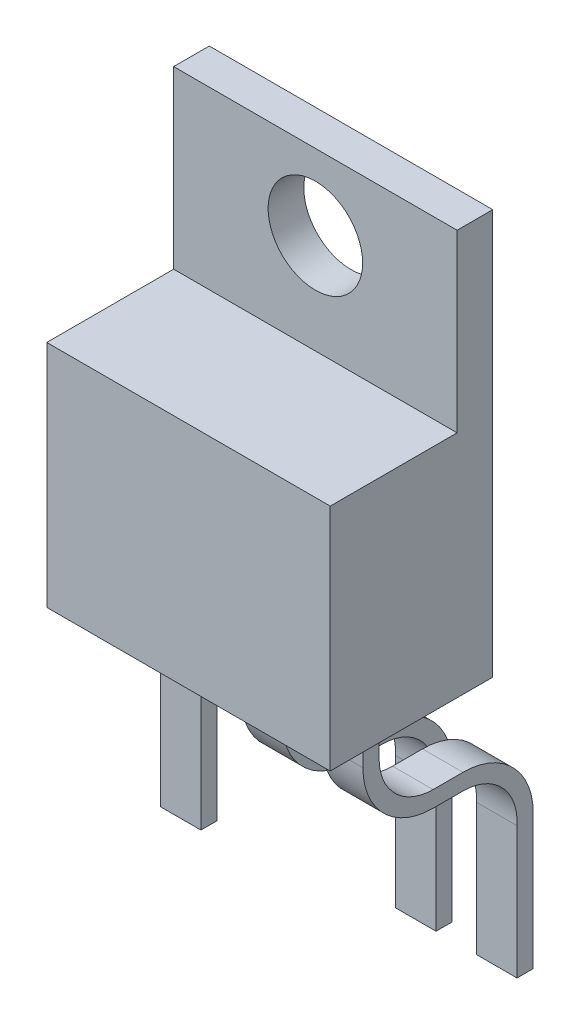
SolidWorks part; units mm, degrees
ref_plane "Спереди" through (0, 0, 0) normal (0, 0, 1) x (1, 0, 0)
ref_plane "Сверху" through (0, 0, 0) normal (0, 1, 0) x (1, 0, 0)
ref_plane "Справа" through (0, 0, 0) normal (1, 0, 0) x (0, 0, -1)
sketch "Эскиз1" plane through (0, 0, 0) normal (0, 0, 1) x (1, 0, 0)
  line L0 (5.25, 15) -> (5.25, 0) construction
  line L1 (0, 0) -> (10.5, 0)
  line L2 (0, 0) -> (0, 15)
  line L3 (0, 15) -> (10.5, 15)
  line L4 (10.5, 0) -> (10.5, 15)
  circle A0 centre (5.25, 12.2) radius 1.75
  dimension "D3" = 3.5
  dimension "D4" = 2.8
  dimension "D1" = 10.5
  dimension "D2" = 15
extrude "Бобышка-Вытянуть1" add sketch "Эскиз1" along normal blind 1.32
sketch "Эскиз2" plane through (0, 0, 1.32) normal (0, 0, 1) x (1, 0, 0)
  line L0 (10.5, 0) -> (10.5, 15) construction
  line L1 (0, 0) -> (10.5, 0)
  line L2 (0, 0) -> (0, 8.5)
  line L3 (0, 8.5) -> (10.5, 8.5)
  line L4 (10.5, 0) -> (10.5, 8.5)
  line L5 (10.5, 15) -> (0, 15) construction
  dimension "D1" = 6.5
extrude "Бобышка-Вытянуть2" add sketch "Эскиз2" along normal blind 4.7
sketch "Эскиз3" plane through (10.5, 0, 0) normal (1, 0, 0) x (0, 0, -1)
  line L0 (-3.01, 0) -> (-3.01, -2.8764) construction
  line L1 (-6.02, 0) -> (0, 0) construction
  line L2 (-2.71, -2) -> (-2.71, 0)
  line L3 (3, -6.6) -> (3, -11.6)
  line L4 (-0.71, -4) -> (0.4, -4)
  line L5 (2.4, -6.71) -> (2.4, -11.6)
  line L6 (-3.31, -2) -> (-3.31, 0)
  line L7 (-3.31, 0) -> (-2.71, 0)
  line L8 (2.4, -11.6) -> (3, -11.6)
  line L9 (-0.71, -4.6) -> (0.4, -4.6)
  line L10 (0, 0) -> (0, 15) construction
  arc A0 (-2.71, -2) -> (-0.71, -4) centre (-0.71, -2) ccw
  arc A1 (0.4, -4) -> (3, -6.6) centre (0.4, -6.6) cw
  arc A2 (2.4, -6.71) -> (0.4, -4.6) centre (0.4, -6.6029) ccw
  arc A3 (-3.31, -2) -> (-0.71, -4.6) centre (-0.71, -2) ccw
  arc A4 (-0.71, -4) -> (3, -6.6) centre (-0.71, -7.9469) cw construction
  arc A5 (-0.71, -4.6) -> (2.4, -6.71) centre (-0.71, -7.9469) cw construction
  dimension "D2" = 2
  dimension "D6" = 3
  dimension "D1" = 0.6
  dimension "D3" = 2
  dimension "D4" = 5
  dimension "D5" = 0.6
extrude "Бобышка-Вытянуть3" add sketch "Эскиз3" against normal blind 10.5
sketch "Эскиз4" plane through (0, 0, 3.31) normal (0, 0, 1) x (1, 0, 0)
  line L0 (5.25, 0) -> (5.25, -11.6) construction
  line L1 (0, 0) -> (10.5, 0) construction
  line L2 (0, -11.6) -> (10.5, -11.6) construction
  line L3 (0, 0) -> (10.5, 0) construction
  line L4 (6, 0) -> (7.5, 0)
  line L5 (6, 0) -> (6, -11.6)
  line L6 (6, -11.6) -> (7.5, -11.6)
  line L7 (7.5, 0) -> (7.5, -11.6)
  line L8 (0, 0) -> (0, -11.6)
  line L9 (9, 0) -> (10.5, 0)
  line L10 (9, 0) -> (9, -11.6)
  line L11 (9, -11.6) -> (10.5, -11.6)
  line L12 (10.5, 0) -> (10.5, -11.6)
  line L13 (1.5, -11.6) -> (0, -11.6)
  line L14 (1.5, 0) -> (1.5, -11.6)
  line L15 (1.5, 0) -> (0, 0)
  line L16 (3, 0) -> (3, -11.6)
  line L17 (4.5, -11.6) -> (3, -11.6)
  line L18 (4.5, 0) -> (4.5, -11.6)
  line L19 (4.5, 0) -> (3, 0)
  dimension "D1" = 1.5
  dimension "D2" = 1.5
  dimension "D3" = 1.5
extrude "Вырез-Вытянуть1" cut sketch "Эскиз4" against normal through all
sketch "Эскиз5" plane through (1.5, 0, 0) normal (-1, 0, 0) x (0, 0, 1)
  line L1 (3.31, -2) -> (-3, -2)
  line L2 (3.31, -2) -> (3.31, -11.6)
  line L3 (3.31, -11.6) -> (-3, -11.6)
  line L4 (-3, -2) -> (-3, -11.6)
extrude "Вырез-Вытянуть2" cut sketch "Эскиз5" against normal up to next
sketch "Эскиз6" plane through (0, -2, 0) normal (0, -1, 0) x (1, 0, 0)
  line L1 (1.5, 3.31) -> (3, 3.31)
  line L2 (1.5, 3.31) -> (1.5, 2.71)
  line L3 (1.5, 2.71) -> (3, 2.71)
  line L4 (3, 3.31) -> (3, 2.71)
extrude "Бобышка-Вытянуть4" add sketch "Эскиз6" along normal blind 5
